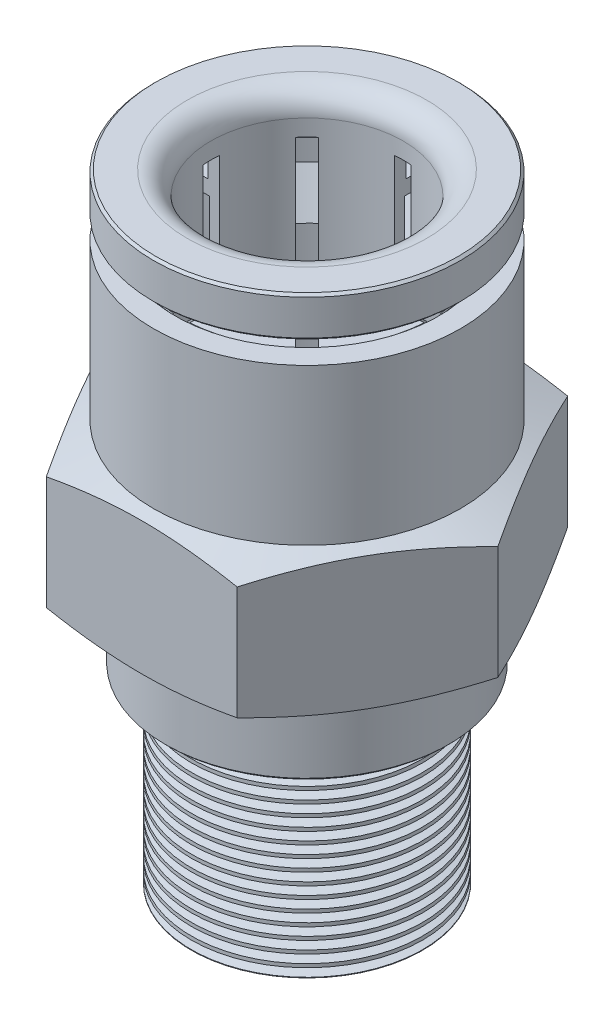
SolidWorks part; units mm, degrees
ref_plane "Alzado" through (0, 0, 0) normal (0, 0, 1) x (1, 0, 0)
ref_plane "Planta" through (0, 0, 0) normal (0, 1, 0) x (1, 0, 0)
ref_plane "Vista lateral" through (0, 0, 0) normal (1, 0, 0) x (0, 0, -1)
sketch "Croquis1" plane through (0, 0, 0) normal (0, 0, 1) x (1, 0, 0)
  line L0 (-3.25, 0) -> (-4.9, 0)
  line L1 (-4.9, 0) -> (-4.9, 8)
  line L2 (-4.9, 8) -> (-6, 8)
  line L3 (-6, 8) -> (-6, 11)
  line L4 (-6, 11) -> (-8.5, 11)
  line L5 (-8.5, 11) -> (-8.5, 17)
  line L6 (-8.5, 17) -> (-6.5, 17)
  line L7 (-6.5, 17) -> (-6.5, 23.6)
  line L8 (-6.5, 23.6) -> (-5.475, 23.6)
  line L9 (-5.475, 23.6) -> (-5.475, 22.6)
  line L10 (-5.475, 22.6) -> (-4.7, 20.9)
  line L11 (-4.7, 20.9) -> (-4.7, 18.9)
  line L12 (-4.7, 18.9) -> (-5.5, 17.9)
  line L13 (-5.5, 17.9) -> (-5.5, 13)
  line L14 (-5.5, 13) -> (-4, 13)
  line L15 (-4, 13) -> (-4, 9)
  line L16 (-4, 9) -> (-2.75, 9)
  line L17 (-2.75, 9) -> (-2.75, 6)
  line L18 (0, 0) -> (0, 23.6) construction
  line L19 (-2.75, 6) -> (-3.25, 6)
  line L20 (-3.25, 6) -> (-3.25, 0)
  dimension "D1" = 23.6
  dimension "D2" = 8
  dimension "D3" = 3
  dimension "D4" = 6
  dimension "D5" = 4.9
  dimension "D6" = 6
  dimension "D7" = 8.5
  dimension "D8" = 6.5
  dimension "D9" = 5.475
  dimension "D10" = 1
  dimension "D11" = 2.7
  dimension "D12" = 4.7
  dimension "D13" = 2
  dimension "D14" = 6
  dimension "D15" = 3.25
  dimension "D16" = 2.75
  dimension "D17" = 4
  dimension "D18" = 3
  dimension "D19" = 4
  dimension "D20" = 5.5
  dimension "D21" = 1
revolve "Revolución1" add sketch "Croquis1" angle 360 about L18
sketch "Croquis2" plane through (0, 0, 0) normal (0, 0, 1) x (1, 0, 0)
  line L0 (-5.4, 7.5) -> (-5.4, 6.9)
  line L1 (-5.4, 6.9) -> (-4.2, 7.2)
  line L3 (-4.2, 7.2) -> (-5.4, 7.5)
  line L4 (-5.4, 7.2) -> (-4.2, 7.2) construction
  line L5 (-4.9, 8) -> (4.9, 8) construction
  dimension "D2" = 0.6
  dimension "D3" = 1.2
  dimension "D4" = 0.5
  dimension "D5" = 4.2
revolve "Cortar-Revolución1" cut sketch "Croquis2" angle 360 about axis through (0, 0, 0) along (0, -1, 0)
pattern_linear "MatrizL1" count 15 spacing 0.5 along (0, -1, 0) of "Cortar-Revolución1"
sketch "Croquis4" plane through (0, 0, 0) normal (0, 0, 1) x (1, 0, 0)
  line L0 (4, 13) -> (-4, 13) construction
  circle A0 centre (-4.5, 14) radius 1
  dimension "D1" = 2
  dimension "D2" = 4.5
revolve "Revolución2" add sketch "Croquis4" angle 360 about axis through (0, 0, 0) along (0, -1, 0)
sketch "Croquis5" plane through (0, 0, 0) normal (0, 0, 1) x (1, 0, 0)
  line L0 (0, 22.6) -> (0, 20.9) construction
  line L1 (-4.075, 26.2) -> (-6.5, 26.2)
  line L2 (-6.5, 26.2) -> (-6.5, 24.5)
  line L3 (-6.5, 24.5) -> (-4.55, 24.5)
  line L4 (-4.55, 24.5) -> (-4.55, 23.4)
  line L5 (-4.55, 23.4) -> (-5.425, 23.4)
  line L6 (-5.425, 23.4) -> (-5.425, 22.8)
  line L7 (-5.425, 22.8) -> (-4.5, 22.8)
  line L8 (-4.5, 22.8) -> (-4.5, 17.8)
  line L9 (-4.5, 17.8) -> (-5.05, 17.8)
  line L10 (-5.05, 17.8) -> (-5.05, 16.25)
  line L11 (-5.05, 16.25) -> (-3.5, 16.25)
  line L12 (-4.075, 26.2) -> (-4.075, 16.95)
  line L13 (-4.075, 16.95) -> (-3.5, 16.25)
  line L14 (0, 10.8631) -> (0, 20.2738) construction
  line L16 (5.5, 13) -> (-5.5, 13) construction
  dimension "D1" = 6.5
  dimension "D2" = 4.075
  dimension "D3" = 4.55
  dimension "D4" = 5.425
  dimension "D5" = 1.7
  dimension "D6" = 3.4
  dimension "D7" = 0.6
  dimension "D8" = 5
  dimension "D9" = 4.5
  dimension "D10" = 5.05
  dimension "D11" = 3.5
  dimension "D12" = 9.95
  dimension "D13" = 0.7
  dimension "D14" = 3.25
revolve "Revolución3" add sketch "Croquis5" angle 360 about axis through (0, 0, 0) along (0, -1, 0)
chamfer "Chaflán1" distance 1 angle 10 1 edges at (0, 16.25, 3.5)
chamfer "Chaflán2" distance 0.2 angle 45 2 edges at (0, 17.8, 5.05) (0, 16.25, 5.05)
chamfer "Chaflán3" distance 0.1 angle 45 4 edges at (0, 22.8, 5.425) (0, 23.4, 5.425) (0, 26.2, 6.5) (0, 24.5, 6.5)
sketch "Croquis6" plane through (0, 16.25, 0) normal (0, -1, 0) x (1, 0, 0)
  line L0 (0, 5.425) -> (0, 3.5) construction
  line L1 (-0.35, 5.4137) -> (-0.35, 3.4825)
  line L2 (0.35, 5.4137) -> (0.35, 3.4825)
  line L3 (-0.35, 5.05) -> (-0.35, 3.5) construction
  line L4 (0.35, 5.05) -> (0.35, 3.5) construction
  line L5 (0, 5.05) -> (0, 3.5) construction
  circle A1 centre (0, 0) radius 3.5 construction
  arc A5 (0.35, 3.4825) -> (-0.35, 3.4825) centre (0, 0) ccw
  arc A7 (0.35, 5.4137) -> (-0.35, 5.4137) centre (0, 0) ccw
  circle A8 centre (0, 0) radius 5.425 construction
  dimension "D1" = 0.35
  dimension "D2" = 0.35
extrude "Cortar-Extruir1" cut sketch "Croquis6" against normal up to surface (8.25 mm away)
pattern_circular "MatrizC1" count 8 over 360 about axis through (0, 0, 0) along (0, 1, 0) of "Cortar-Extruir1"
fillet "Redondeo1" radius 1 1 edges at (0, 26.2, 4.075)
sketch "Croquis7" plane through (0, 17, 0) normal (0, 1, 0) x (1, 0, 0)
  line L0 (0, 7) -> (0, 0) construction
  line L1 (8.0829, 0) -> (4.0415, 7)
  line L2 (4.0415, 7) -> (-4.0415, 7)
  line L3 (-4.0415, 7) -> (-8.0829, 0)
  line L4 (-8.0829, 0) -> (-4.0415, -7)
  line L5 (-4.0415, -7) -> (4.0415, -7)
  line L6 (4.0415, -7) -> (8.0829, 0)
  circle A0 centre (0, 0) radius 7 construction
  circle A1 centre (0, 0) radius 12.5
  dimension "D1" = 14
  dimension "D2" = 25
extrude "Cortar-Extruir2" cut sketch "Croquis7" against normal blind 10
sketch "Croquis8" plane through (0, 0, 0) normal (0, 0, 1) x (1, 0, 0)
  line L0 (-6.5, 17) -> (-8.0829, 16.4)
  line L1 (-8.0829, 16.4) -> (-8.0829, 17)
  line L2 (-8.0829, 17) -> (-6.5, 17)
  line L3 (-8.0829, 14) -> (-4.0415, 14) construction
  line L4 (-8.0829, 11) -> (-8.0829, 17) construction
  line L5 (-4.0415, 11) -> (-4.0415, 17) construction
  line L6 (-8.0829, 11) -> (-6.5, 11)
  line L7 (-8.0829, 11.6) -> (-8.0829, 11)
  line L8 (-6.5, 11) -> (-8.0829, 11.6)
  dimension "D1" = 2.4
revolve "Cortar-Revolución2" cut sketch "Croquis8" angle 360
chamfer "Chaflán4" distance 0.1 angle 45 3 edges at (0, 0, -3.25) (0, 8, -6) (0, 23.6, -5.475)
scale "Skalieren2" bodies to scale 107 109 scale about origin uniform scaling yes scale factor 0.5
scale "Skalieren3" bodies to scale 104 scale about origin uniform scaling yes scale factor 0.5
scale "Skalieren5" bodies to scale 112 113 scale about origin uniform scaling yes scale factor 1.082
